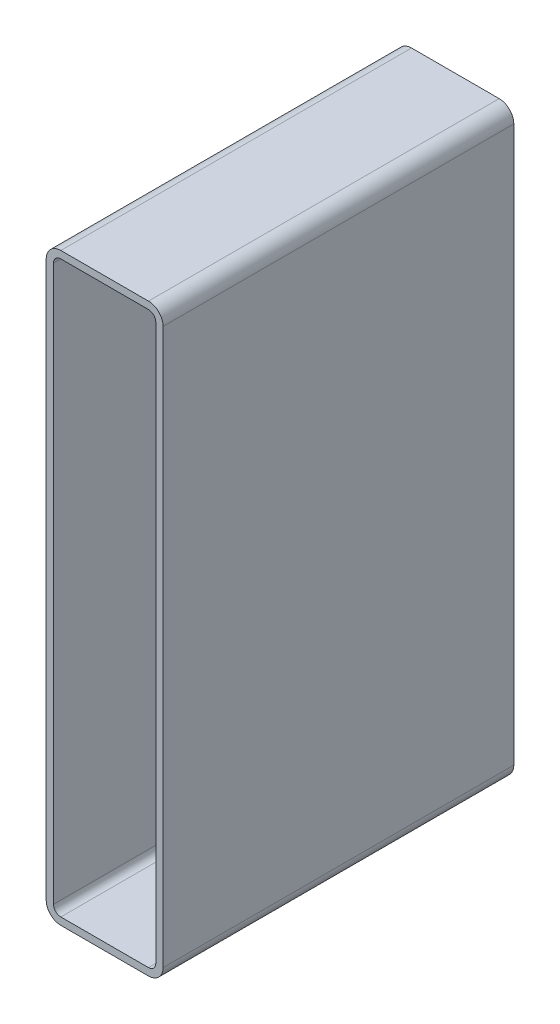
SolidWorks part; units mm, degrees
ref_plane "Front Plane" through (0, 0, 0) normal (0, 0, 1) x (1, 0, 0)
ref_plane "Top Plane" through (0, 0, 0) normal (0, 1, 0) x (1, 0, 0)
ref_plane "Right Plane" through (0, 0, 0) normal (1, 0, 0) x (0, 0, -1)
sketch "Sketch1" plane through (0, 0, 0) normal (0, 0, 1) x (1, 0, 0)
sketch_block_instance "HSS20x4x0.250-1"
sketch_block "HSS20x4x0.250"
extrude "Boss-Extrude1" add sketch "Sketch1" along normal blind 304.8
